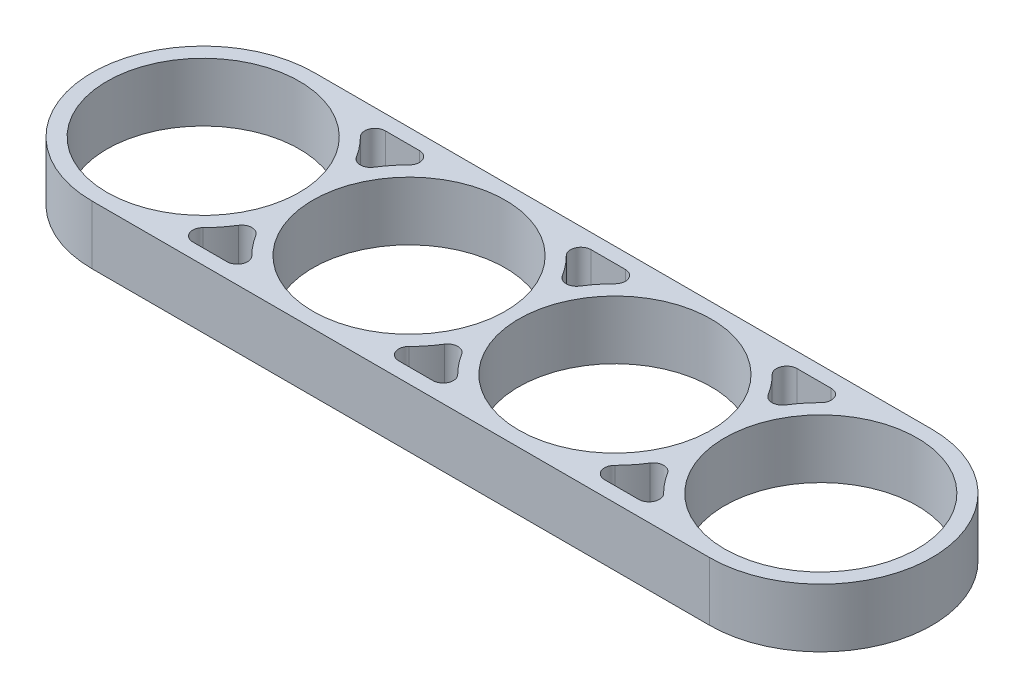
SolidWorks part; units mm, degrees
ref_plane "Ebene vorne" through (0, 0, 0) normal (0, 0, 1) x (1, 0, 0)
ref_plane "Ebene oben" through (0, 0, 0) normal (0, 1, 0) x (1, 0, 0)
ref_plane "Ebene rechts" through (0, 0, 0) normal (1, 0, 0) x (0, 0, -1)
sketch "Skizze1" plane through (0, 0, 0) normal (0, 1, 0) x (1, 0, 0)
  line L0 (-50, 0) -> (50, 0) construction
  line L1 (-34.5966, 10.8) -> (25.4034, 10.8)
  line L2 (-26.2589, 9.35) -> (-22.9344, 9.35)
  line L3 (-34.5966, -10.8) -> (25.4034, -10.8)
  line L4 (-26.2589, -9.35) -> (-22.9344, -9.35)
  line L5 (-6.2589, -9.35) -> (-2.9344, -9.35)
  line L6 (13.7411, -9.35) -> (17.0656, -9.35)
  line L7 (13.7411, 9.35) -> (17.0656, 9.35)
  line L8 (-6.2589, 9.35) -> (-2.9344, 9.35)
  circle A0 centre (-34.5966, 0) radius 9.35
  circle A1 centre (-14.5966, 0) radius 9.35
  circle A2 centre (5.4034, 0) radius 9.35
  circle A3 centre (25.4034, 0) radius 9.35
  arc A4 (-25.4441, 5.7333) -> (-26.9655, 7.6424) centre (-34.5966, 0) ccw
  arc A5 (-5.4441, 5.7333) -> (-6.9655, 7.6424) centre (-14.5966, 0) ccw
  arc A6 (-3.7492, -5.7333) -> (-2.2278, -7.6424) centre (5.4034, 0) ccw
  arc A7 (16.2508, -5.7333) -> (17.7722, -7.6424) centre (25.4034, 0) ccw
  arc A8 (14.5559, 5.7333) -> (13.0345, 7.6424) centre (5.4034, 0) ccw
  arc A9 (-23.7492, -5.7333) -> (-22.2278, -7.6424) centre (-14.5966, 0) ccw
  arc A10 (-26.9655, -7.6424) -> (-25.4441, -5.7333) centre (-34.5966, 0) ccw
  arc A11 (-6.9655, -7.6424) -> (-5.4441, -5.7333) centre (-14.5966, 0) ccw
  arc A12 (13.0345, -7.6424) -> (14.5559, -5.7333) centre (5.4034, 0) ccw
  arc A13 (25.4034, -10.8) -> (25.4034, 10.8) centre (25.4034, 0) ccw
  arc A14 (-2.2278, 7.6424) -> (-3.7492, 5.7333) centre (5.4034, 0) ccw
  arc A15 (17.7722, 7.6424) -> (16.2508, 5.7333) centre (25.4034, 0) ccw
  arc A16 (-22.2278, 7.6424) -> (-23.7492, 5.7333) centre (-14.5966, 0) ccw
  arc A17 (-34.5966, 10.8) -> (-34.5966, -10.8) centre (-34.5966, 0) ccw
  arc A18 (-26.2589, -9.35) -> (-26.9655, -7.6424) centre (-26.2589, -8.35) cw
  arc A19 (-22.9344, -9.35) -> (-22.2278, -7.6424) centre (-22.9344, -8.35) ccw
  arc A20 (-23.7492, -5.7333) -> (-25.4441, -5.7333) centre (-24.5966, -6.2642) ccw
  arc A21 (-6.2589, -9.35) -> (-6.9655, -7.6424) centre (-6.2589, -8.35) cw
  arc A22 (-2.9344, -9.35) -> (-2.2278, -7.6424) centre (-2.9344, -8.35) ccw
  arc A23 (-3.7492, -5.7333) -> (-5.4441, -5.7333) centre (-4.5966, -6.2642) ccw
  arc A24 (13.7411, -9.35) -> (13.0345, -7.6424) centre (13.7411, -8.35) cw
  arc A25 (17.0656, -9.35) -> (17.7722, -7.6424) centre (17.0656, -8.35) ccw
  arc A26 (16.2508, -5.7333) -> (14.5559, -5.7333) centre (15.4034, -6.2642) ccw
  arc A27 (16.2508, 5.7333) -> (14.5559, 5.7333) centre (15.4034, 6.2642) cw
  arc A28 (17.7722, 7.6424) -> (17.0656, 9.35) centre (17.0656, 8.35) ccw
  arc A29 (13.0345, 7.6424) -> (13.7411, 9.35) centre (13.7411, 8.35) cw
  arc A30 (-5.4441, 5.7333) -> (-3.7492, 5.7333) centre (-4.5966, 6.2642) ccw
  arc A31 (-2.2278, 7.6424) -> (-2.9344, 9.35) centre (-2.9344, 8.35) ccw
  arc A32 (-6.9655, 7.6424) -> (-6.2589, 9.35) centre (-6.2589, 8.35) cw
  arc A33 (-25.4441, 5.7333) -> (-23.7492, 5.7333) centre (-24.5966, 6.2642) ccw
  arc A34 (-22.2278, 7.6424) -> (-22.9344, 9.35) centre (-22.9344, 8.35) ccw
  arc A35 (-26.2589, 9.35) -> (-26.9655, 7.6424) centre (-26.2589, 8.35) ccw
  point P33 (-29.1913, -9.35)
  point P53 (15.4034, 4.0792)
  point P58 (10.8087, 9.35)
  dimension "D1" = 21.6
  dimension "D2" = 18.7
  dimension "D6" = 10.8
  dimension "D7" = 10.8
  dimension "D8" = 1
  dimension "D3" = 20
  dimension "D4" = 20
  dimension "D5" = 20
extrude "Aufsatz-Linear austragen1" add sketch "Skizze1" along normal blind 5.7
